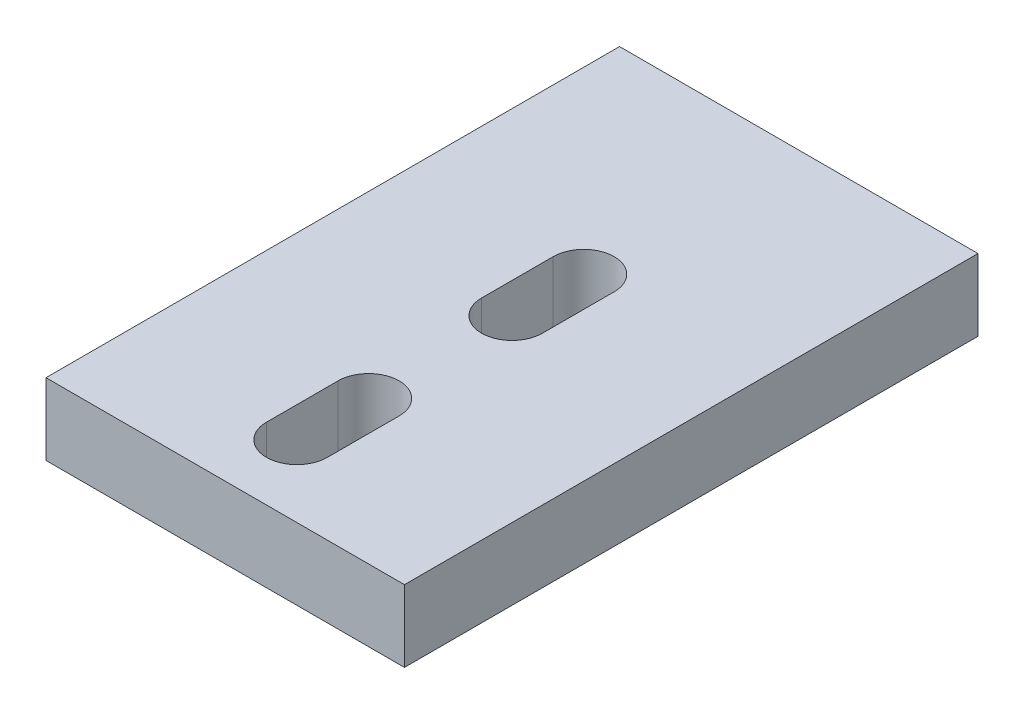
SolidWorks part; units mm, degrees
ref_plane "Plan de face" through (0, 0, 0) normal (0, 0, 1) x (1, 0, 0)
ref_plane "Plan de dessus" through (0, 0, 0) normal (0, 1, 0) x (1, 0, 0)
ref_plane "Plan de droite" through (0, 0, 0) normal (1, 0, 0) x (0, 0, -1)
sketch "Esquisse1" plane through (0, 0, 0) normal (0, 0, 1) x (1, 0, 0)
  line L0 (-50, 0) -> (0, 0)
  line L1 (0, 0) -> (0, -10)
  line L2 (0, -10) -> (-50, -10)
  line L7 (-50, -10) -> (-50, 0)
  dimension "D1" = 10
  dimension "D4" = 50
extrude "Extrusion1" add sketch "Esquisse1" along normal mid plane 80
sketch "Esquisse4" plane through (0, 0, 0) normal (0, 1, 0) x (-1, 0, 0)
  line L0 (25, 30) -> (25, 20) construction
  line L1 (50, 40) -> (50, -40) construction
  line L2 (0, 40) -> (50, 40) construction
  line L3 (20.75, 30) -> (20.75, 20)
  line L4 (29.25, 30) -> (29.25, 20)
  arc A0 (20.75, 30) -> (29.25, 30) centre (25, 30) cw
  arc A1 (20.75, 20) -> (29.25, 20) centre (25, 20) ccw
  point P4 (25, 25)
  dimension "D1" = 25
  dimension "D2" = 15
  dimension "D3" = 10
  dimension "D4" = 4.25
  dimension "D5" = 4.25
extrude "Enlèv. mat.-Extru.1" cut sketch "Esquisse4" against normal up to next
pattern_linear "Répétition linéaire1" count 2 spacing 30 along (0, 0, -1) of "Enlèv. mat.-Extru.1"
